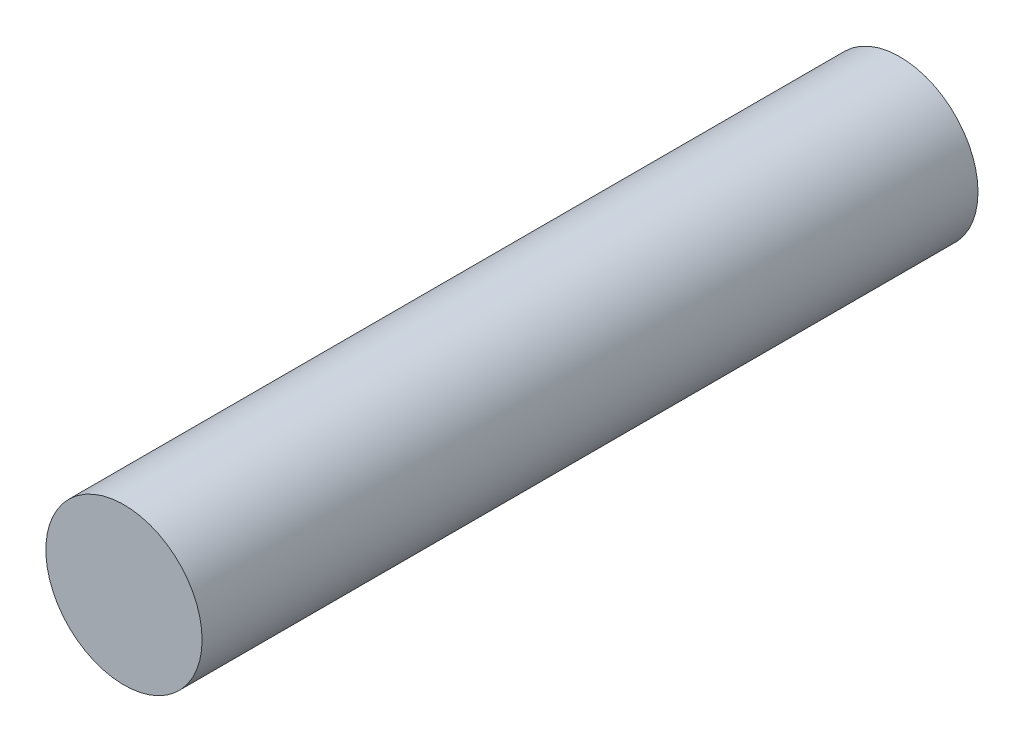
SolidWorks part; units mm, degrees
ref_plane "Front Plane" through (0, 0, 0) normal (0, 0, 1) x (1, 0, 0)
ref_plane "Top Plane" through (0, 0, 0) normal (0, 1, 0) x (1, 0, 0)
ref_plane "Right Plane" through (0, 0, 0) normal (1, 0, 0) x (0, 0, -1)
sketch "Sketch1" plane through (0, 0, 0) normal (0, 0, 1) x (1, 0, 0)
  circle A0 centre (0, 0) radius 75
  dimension "D1" = 150
extrude "Boss-Extrude1" add sketch "Sketch1" along normal mid plane 745
